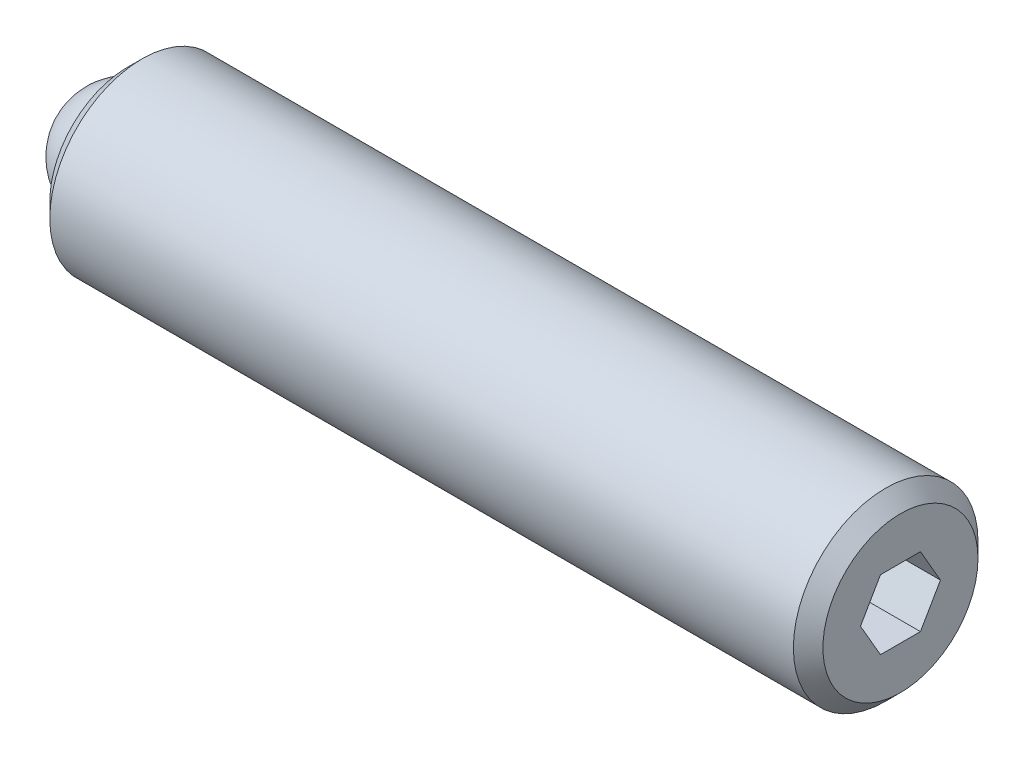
SolidWorks part; units mm, degrees
ref_plane "Front Plane" through (0, 0, 0) normal (0, 0, 1) x (1, 0, 0)
ref_plane "Top Plane" through (0, 0, 0) normal (0, 1, 0) x (1, 0, 0)
ref_plane "Right Plane" through (0, 0, 0) normal (1, 0, 0) x (0, 0, -1)
sketch "Sketch2" plane through (0, 0, 0) normal (1, 0, 0) x (0, 0, -1)
  circle A0 centre (0, 0) radius 3.175
  dimension "D1" = 6.35
extrude "Boss-Extrude1" add sketch "Sketch2" along normal blind 26.5906
sketch "Sketch3" plane through (0, 0, 0) normal (-1, 0, 0) x (0, 0, 1)
  circle A0 centre (0, 0) radius 1.9812
  dimension "D1" = 3.9624
chamfer "Chamfer1" distance 0.508 angle 45 1 edges at (0, 0, -3.175)
chamfer "Chamfer2" distance 0.508 angle 45 1 edges at (26.5906, 0, -3.175)
sketch "Sketch4" plane through (26.5906, 0, 0) normal (1, 0, 0) x (0, 0, -1)
  line L1 (1.3748, 0) -> (0.6874, 1.1906)
  line L2 (0.6874, 1.1906) -> (-0.6874, 1.1906)
  line L3 (-0.6874, 1.1906) -> (-1.3748, 0)
  line L4 (-1.3748, 0) -> (-0.6874, -1.1906)
  line L5 (-0.6874, -1.1906) -> (0.6874, -1.1906)
  line L6 (0.6874, -1.1906) -> (1.3748, 0)
  circle A0 centre (0, 0) radius 1.1906 construction
  dimension "D1" = 2.3813
extrude "Cut-Extrude2" cut sketch "Sketch4" against normal blind 2.286
extrude "Cut-Extrude3" cut sketch "Sketch3" against normal blind 1.9844
sketch "Sketch5" plane through (0, 0, 0) normal (-1, 0, 0) x (0, 0, 1)
  line L0 (0, 0) -> (0, -1.9844)
  line L1 (0, 0) -> (0, 1.9844)
  arc A0 (0, 1.9844) -> (0, -1.9844) centre (0, 0) ccw
  dimension "D1" = 1.9844
revolve "Revolve1" add sketch "Sketch5" angle 360 about L1
